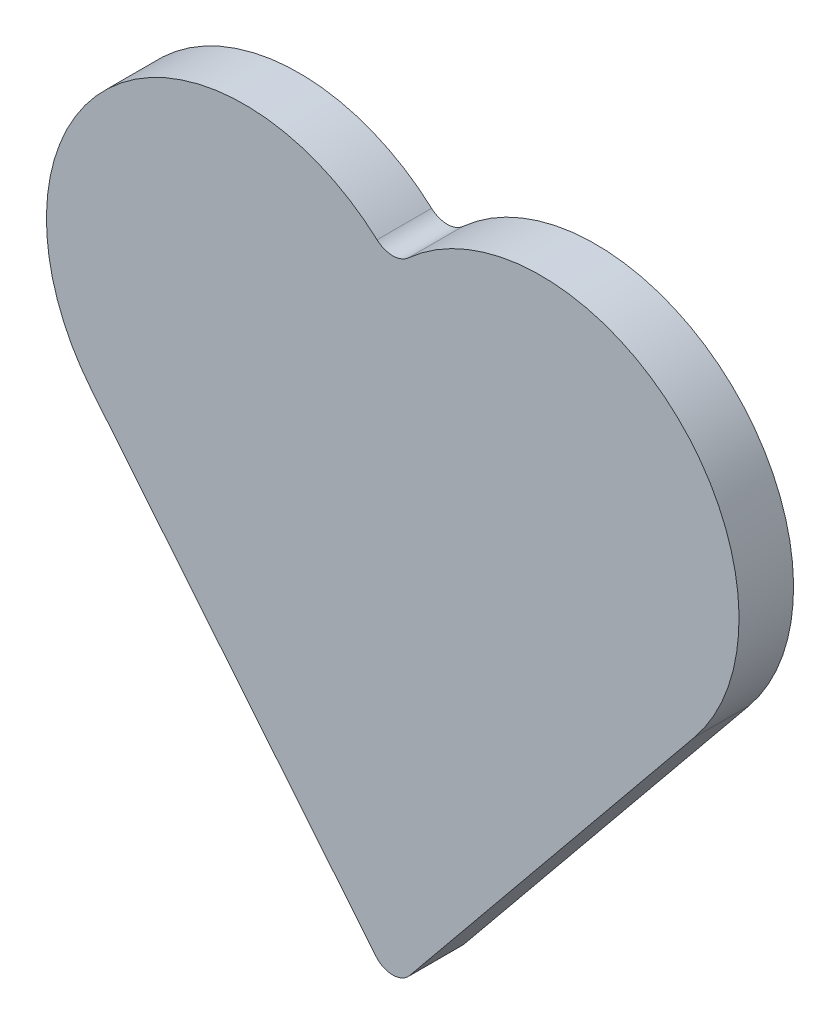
SolidWorks part; units mm, degrees
ref_plane "Front Plane" through (0, 0, 0) normal (0, 0, 1) x (1, 0, 0)
ref_plane "Top Plane" through (0, 0, 0) normal (0, 1, 0) x (1, 0, 0)
ref_plane "Right Plane" through (0, 0, 0) normal (1, 0, 0) x (0, 0, -1)
sketch "Sketch1" plane through (0, 0, 0) normal (0, 0, 1) x (1, 0, 0)
  line L0 (-2.7193, 0) -> (2.7193, 0) construction
  line L2 (-5.5313, -2.2967) -> (0, -9.0693)
  line L3 (0, -9.0693) -> (5.5313, -2.2967)
  line L4 (0, 0) -> (0, -9.0693) construction
  line L5 (0, 0) -> (0, 3.0141) construction
  line L6 (-6.35, 3.6307) -> (6.35, 3.6307) construction
  line L7 (-6.35, 3.6307) -> (-6.35, -9.0693) construction
  line L8 (-6.35, -9.0693) -> (6.35, -9.0693) construction
  line L9 (6.35, 3.6307) -> (6.35, -9.0693) construction
  circle A0 centre (-2.7193, 0) radius 3.6307
  circle A1 centre (2.7193, 0) radius 3.6307
  arc A2 (-0.2872, 2.6958) -> (0.2872, 2.6958) centre (0, 3.0141) ccw
  point P16 (0, -8.1899)
  point P17 (3.2921, -0.3258)
  point P18 (1.7316, 0)
  point P19 (2.396, 0)
  point P20 (0, 3.4904)
  point P21 (0, -9.6731)
  point P22 (0, 3.7221)
  point P23 (0, 1.9431)
  point P24 (-3.0734, 0)
  point P25 (0, 3.0141)
  dimension "D4" = 0.4287
  dimension "D1" = 12.7
  dimension "D2" = 12.7
  dimension "D3" = 5.4385
extrude "Boss-Extrude1" add sketch "Sketch1" along normal blind 1 contours A1 A0 L2 L3 | A1 A0 | A0 A1 | A0 A1 | A2 A0 A1
fillet "Fillet1" radius 0.4 1 edges at (0, -9.0693, 0.5)
